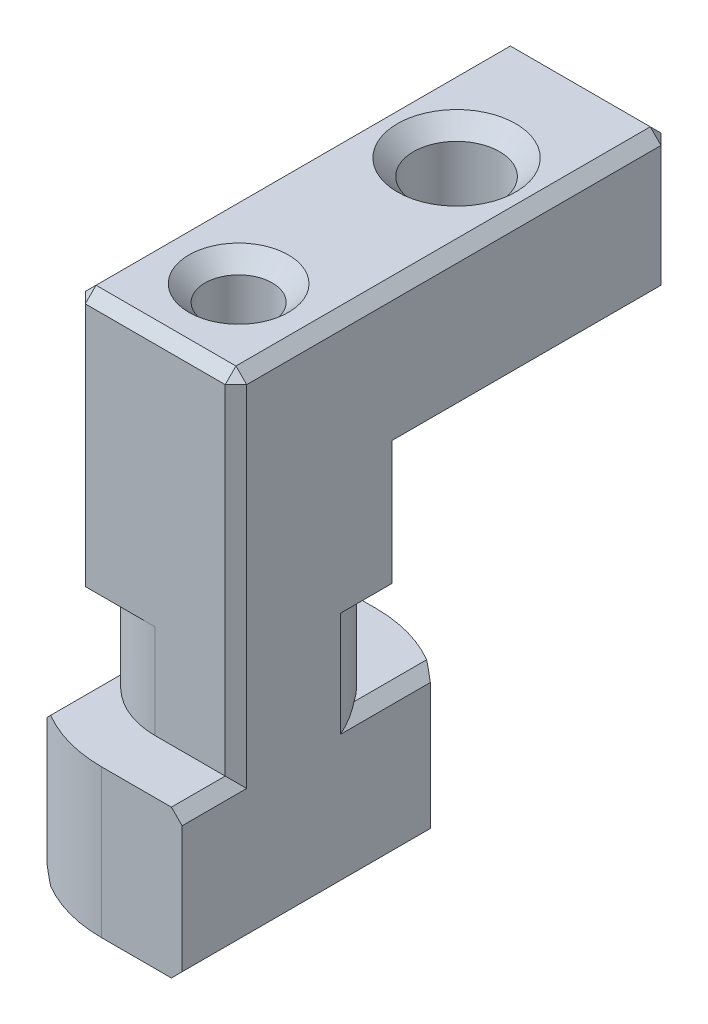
SolidWorks part; units mm, degrees
ref_plane "前基準面" through (0, 0, 0) normal (0, 0, 1) x (1, 0, 0)
ref_plane "上基準面" through (0, 0, 0) normal (0, 1, 0) x (1, 0, 0)
ref_plane "右基準面" through (0, 0, 0) normal (1, 0, 0) x (0, 0, -1)
sketch "草圖2" plane through (0, 0, 0) normal (0, 1, 0) x (1, 0, 0)
  line L4 (3, -5.1) -> (3, 4.1243)
  line L9 (0, 5.1) -> (-3, 5.1)
  line L10 (-3, 5.1) -> (-3, -4.1243)
  line L11 (0, -5.1) -> (3, -5.1)
  arc A3 (3, 4.1243) -> (0, 5.1) centre (0, 0) ccw
  arc A4 (-3, -4.1243) -> (0, -5.1) centre (0, 0) ccw
  point P15 (1.5, -5.1)
  dimension "D1" = 6
  dimension "D3" = 5.1
  dimension "D2" = 10.2
  dimension "D4" = 3
extrude "填料-伸長1" add sketch "草圖2" along normal blind 5.5 contours L11 L4 A3 L9 L10 A4
sketch "草圖3" plane through (0, 5.5, 0) normal (0, 1, 0) x (1, 0, 0)
  line L0 (-3, 3.1) -> (0, 3.1)
  line L3 (3, 0.781) -> (3, -3.1)
  line L4 (3, -3.1) -> (0, -3.1)
  line L5 (-3, -0.781) -> (-3, 3.1)
  arc A0 (0, 3.1) -> (3, 0.781) centre (0, 0) cw
  arc A1 (0, -3.1) -> (-3, -0.781) centre (0, 0) cw
  dimension "D4" = 3
  dimension "D1" = 6.2
  dimension "D2" = 3.1
  dimension "D3" = 6
extrude "填料-伸長2" add sketch "草圖3" along normal blind 3.5
sketch "草圖18" plane through (0, 9, 0) normal (0, 1, 0) x (1, 0, 0)
  line L1 (-3, 3.1) -> (3, 3.1)
  line L2 (-3, 3.1) -> (-3, -3.1)
  line L3 (-3, -3.1) -> (3, -3.1)
  line L4 (3, 3.1) -> (3, -3.1)
  line L5 (-3, 3.1) -> (3, -3.1) construction
  line L6 (-3, -3.1) -> (3, 3.1) construction
  point P0 (0, 0)
  dimension "D1" = 6.2
  dimension "D2" = 6
extrude "填料-伸長4" add sketch "草圖18" along normal blind 4.2
sketch "草圖4" plane through (0, 13.2, 0) normal (0, 1, 0) x (1, 0, 0)
  line L4 (-3, 13.1) -> (-3, -3.1)
  line L5 (-3, -3.1) -> (3, -3.1)
  line L6 (3, -3.1) -> (3, 13.1)
  line L7 (3, 13.1) -> (-3, 13.1)
  dimension "D3" = 3
  dimension "D1" = 6
  dimension "D2" = 16.2
  dimension "D4" = 3.1
extrude "填料-伸長3" add sketch "草圖4" along normal blind 5.3
sketch "草圖6" plane through (0, 18.5, 0) normal (0, 1, 0) x (1, 0, 0)
  circle A0 centre (0, 0) radius 1.25
  dimension "D1" = 2.5
extrude "除料-伸長1" cut sketch "草圖6" against normal blind 14
sketch "草圖8" plane through (0, 0, 0) normal (0, -1, 0) x (1, 0, 0)
  circle A0 centre (0, 0) radius 1.9
  dimension "D1" = 3.8
extrude "除料-伸長2" cut sketch "草圖8" against normal blind 4.5
sketch "草圖17" plane through (0, 18.5, 0) normal (0, 1, 0) x (1, 0, 0)
  line L2 (3, 13.1) -> (-3, 13.1) construction
  line L3 (3, -3.1) -> (3, 13.1) construction
  circle A0 centre (0, 8.1) radius 1.6
  dimension "D1" = 3.2
  dimension "D2" = 5
  dimension "D3" = 3
extrude "除料-伸長3" cut sketch "草圖17" against normal up to next
chamfer "導角3" distance 0.4 angle 45 19 edges at (3, 12, 3.1) (-3, 9.35, -3.1) (-3, 0, -0.4878) (3, 0, 0.4878) (3, 5.5, -2.4527) (-3, 5.5, 2.4527) (3, 5.5, 4.1) (-3, 5.5, -4.1) (0, 18.5, 3.1) (3, 15.85, -13.1) (3, 11.1, -3.1) (3, 13.2, -8.1) (0, 13.2, -13.1) (-3, 15.85, -13.1) (-3, 13.75, 3.1) (-3, 18.5, -5) (0, 18.5, -13.1) (3, 18.5, -5) (-3, 13.2, -8.1)
chamfer "導角4" distance 0.6 angle 45 3 edges at (0, 18.5, 1.25) (0, 18.5, -6.5) (0, 0, -1.9)
thread "螺紋4" pitch 0.7 start angle 0, offset 0, length 0, pitch 0.7, diameter 4
ref_plane "平面5" through (2, 0.6, 0) normal (0, 0, 1) x (1, 0, 0)
sketch "螺紋輪廓5" plane through (2, 0.6, 0) normal (0, 0, 1) x (1, 0, 0)
  line L0 (0, 0) -> (0, 0.7) construction
  line L11 (0, 0) -> (0, 0.6125)
  line L12 (0, 0.6125) -> (-0.3789, 0.3937)
  line L13 (-0.3789, 0.3937) -> (-0.3789, 0.2187)
  line L15 (-0.3789, 0.2187) -> (0, 0)
  line L17 (-0.3789, 0.3062) -> (0, 0.3062) construction
  point P2 (0, 0)
  dimension "Pitch" = 0.7
  dimension "Profile_Angle" = 60
  dimension "Profile_Land" = 0.175
  dimension "Profile_Height" = 0.3789
